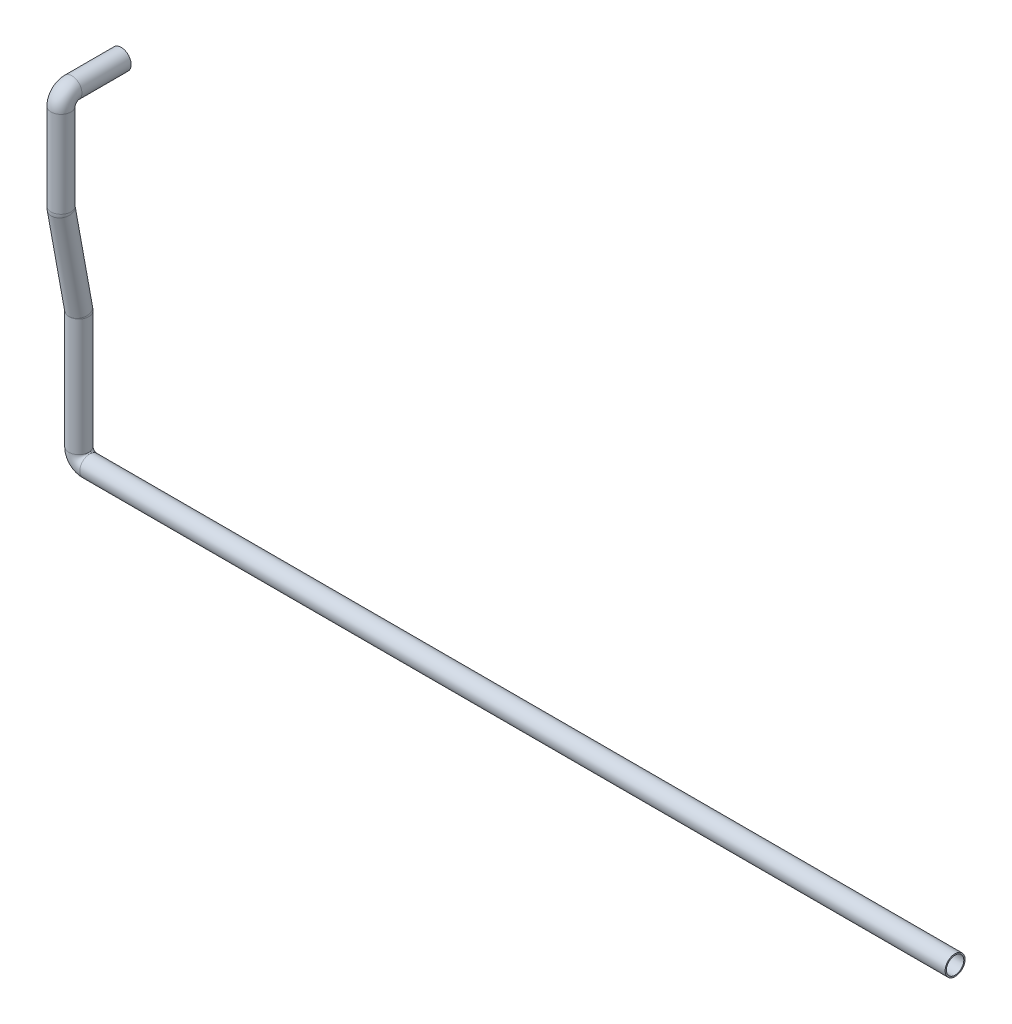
SolidWorks part; units mm, degrees
ref_plane "Alzado" through (0, 0, 0) normal (0, 0, 1) x (1, 0, 0)
ref_plane "Planta" through (0, 0, 0) normal (0, 1, 0) x (1, 0, 0)
ref_plane "Vista lateral" through (0, 0, 0) normal (1, 0, 0) x (0, 0, -1)
sketch3d "Croquis3D1"
  line L2 (0, 0, 0) -> (0, 0, 180)
  line L3 (0, -40, 220) -> (0, -356.3882, 220)
  line L4 (0, -363.5534, 219.353) -> (0, -713.4466, 155.647)
  line L5 (0, -720.6118, 155) -> (0, -1150, 155)
  line L6 (40, -1190, 155) -> (3204, -1190, 155)
  arc A0 (0, -1150, 155) -> (40, -1190, 155) centre (40, -1150, 155) ccw
  arc A1 (0, -713.4466, 155.647) -> (0, -720.6118, 155) centre (0, -720.6118, 195) ccw
  arc A2 (0, -356.3882, 220) -> (0, -363.5534, 219.353) centre (0, -356.3882, 180) ccw
  arc A3 (0, 0, 180) -> (0, -40, 220) centre (0, -40, 180) ccw
  point P9 (0, -1190, 155)
  point P10 (40, -1150, 195)
  point P13 (0, -717, 155)
  point P14 (-40, -720.6118, 195)
  point P17 (0, -360, 220)
  point P18 (40, -356.3882, 180)
  point P21 (0, 0, 220)
  point P22 (40, -40, 180)
  dimension "D8" = 40
  dimension "D1" = 220
  dimension "D2" = 360
  dimension "D3" = 1190
  dimension "D6" = 3204
  dimension "D4" = 190.319
  dimension "D5" = 473
  dimension "D7" = 65
sketch "Croquis1" plane through (0, 0, 0) normal (0, 0, 1) x (1, 0, 0)
  circle A0 centre (0, 0) radius 36.5
  circle A1 centre (0, 0) radius 31.75
  dimension "D1" = 63.5
  dimension "D2" = 73
sweep "Barrer1" add profiles "Croquis1" path "Croquis3D1"
